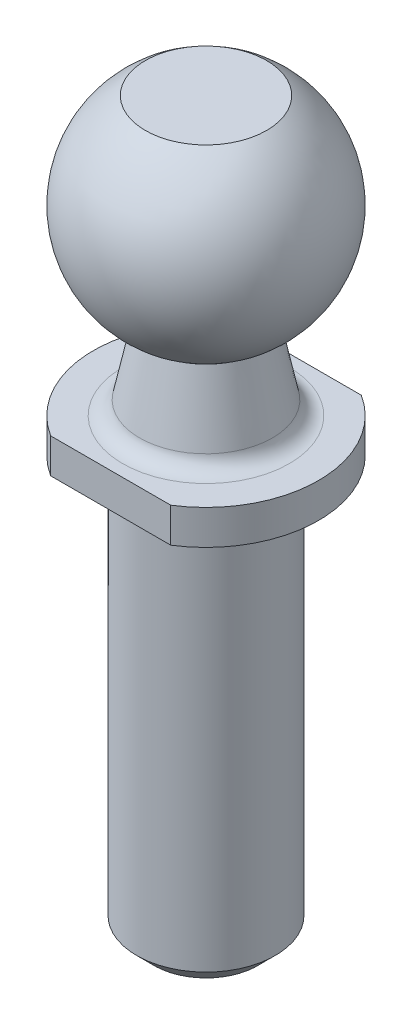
SolidWorks part; units mm, degrees
ref_plane "Face" through (0, 0, 0) normal (0, 0, 1) x (1, 0, 0)
ref_plane "Dessus" through (0, 0, 0) normal (0, 1, 0) x (1, 0, 0)
ref_plane "Droite" through (0, 0, 0) normal (1, 0, 0) x (0, 0, -1)
sketch "Esquisse1" plane through (0, 0, 0) normal (0, 0, 1) x (1, 0, 0)
  line L0 (0, 12.5228) -> (0, -60.5228) construction
  line L1 (4, 0) -> (6.5, 0)
  line L2 (6.5, 0) -> (6.5, 2)
  line L3 (6.5, 2) -> (4, 2)
  line L4 (3, 6.7565) -> (4, 2)
  line L5 (0, -24) -> (0, 18)
  line L6 (0, 18) -> (3.5, 18)
  line L8 (0, -24) -> (4, -24)
  line L9 (4, -24) -> (4, 0)
  arc A0 (3, 6.7565) -> (3.5, 18) centre (0, 12.5228) ccw
  dimension "D6" = 6.5
  dimension "D1" = 18
  dimension "D2" = 42
  dimension "D3" = 3
  dimension "D4" = 2
  dimension "D5" = 4
  dimension "D7" = 3.5
  dimension "D8" = 6.5
  dimension "D9" = 4
revolve "Base-Révolution" add sketch "Esquisse1" angle 360 about L0
fillet "Congé1" radius 1
chamfer "Chanfrein1" distance 1 angle 45
sketch "Esquisse2" plane through (0, 0, 0) normal (0, -1, 0) x (1, 0, 0)
  line L0 (5.3838, 0) -> (-3.7497, 0) construction
  line L1 (7.0763, 5.5) -> (-7.1639, 5.5)
  line L2 (7.0763, 5.5) -> (7.0763, -5.5)
  line L3 (7.0763, -5.5) -> (-7.1639, -5.5)
  line L4 (-7.1639, 5.5) -> (-7.1639, -5.5)
  dimension "D1" = 11
extrude "Enlèv. mat.-Extru.1" cut sketch "Esquisse2" against normal up to surface (2 mm away) flip side to cut
